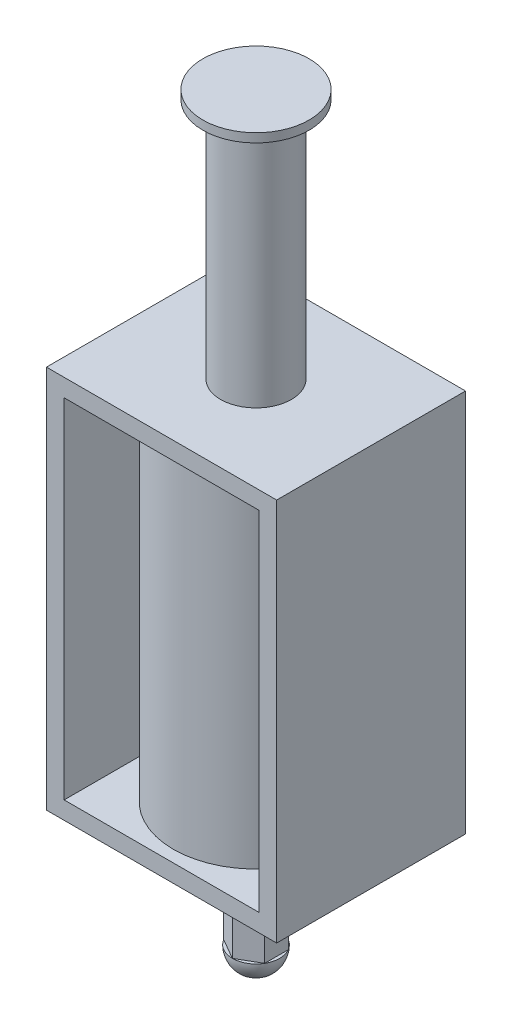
SolidWorks part; units mm, degrees
ref_plane "前视基准面" through (0, 0, 0) normal (0, 0, 1) x (1, 0, 0)
ref_plane "上视基准面" through (0, 0, 0) normal (0, 1, 0) x (1, 0, 0)
ref_plane "右视基准面" through (0, 0, 0) normal (1, 0, 0) x (0, 0, -1)
sketch "草图1" plane through (0, 0, 0) normal (0, 0, 1) x (1, 0, 0)
  line L1 (-19.5, 32.5) -> (19.5, 32.5)
  line L2 (-19.5, 32.5) -> (-19.5, -32.5)
  line L3 (-19.5, -32.5) -> (19.5, -32.5)
  line L4 (19.5, 32.5) -> (19.5, -32.5)
  line L5 (-19.5, 32.5) -> (19.5, -32.5) construction
  line L6 (-19.5, -32.5) -> (19.5, 32.5) construction
  point P0 (0, 0)
  dimension "D1" = 65
  dimension "D2" = 39
extrude "凸台-拉伸1" add sketch "草图1" along normal blind 32 contours L2 L1 L4 L3
sketch "草图2" plane through (0, 0, 32) normal (0, 0, 1) x (1, 0, 0)
  line L0 (19.5, 32.5) -> (19.5, -32.5) construction
  line L1 (-16.5, 29.5) -> (16.5, 29.5)
  line L2 (-16.5, 29.5) -> (-16.5, -29.5)
  line L3 (-16.5, -29.5) -> (16.5, -29.5)
  line L4 (16.5, 29.5) -> (16.5, -29.5)
  line L5 (-16.5, 29.5) -> (16.5, -29.5) construction
  line L6 (-16.5, -29.5) -> (16.5, 29.5) construction
  line L7 (-19.5, -32.5) -> (19.5, -32.5) construction
  point P0 (0, 0)
  dimension "D1" = 3
  dimension "D2" = 3
extrude "切除-拉伸1" cut sketch "草图2" against normal blind 32
sketch "草图3" plane through (0, 32.5, 0) normal (0, 1, 0) x (1, 0, 0)
  line L0 (-19.5, 0) -> (19.5, -32) construction
  line L2 (19.5, 0) -> (-19.5, -32) construction
  circle A1 centre (0, -16) radius 6
extrude "凸台-拉伸2" add sketch "草图3" along normal blind 41
sketch "草图4" plane through (0, 73.5, 0) normal (0, 1, 0) x (1, 0, 0)
  circle A0 centre (0, -16) radius 9
extrude "凸台-拉伸3" add sketch "草图4" along normal blind 1.5
sketch "草图5" plane through (0, 29.5, 0) normal (0, -1, 0) x (1, 0, 0)
  circle A0 centre (0, 16) radius 14
extrude "凸台-拉伸4" add sketch "草图5" along normal blind 59
sketch "草图6" plane through (0, -32.5, 0) normal (0, -1, 0) x (1, 0, 0)
  circle A0 centre (0, 16) radius 4
extrude "凸台-拉伸5" add sketch "草图6" along normal blind 18
sketch "草图7" plane through (0, -50.5, 0) normal (0, -1, 0) x (1, 0, 0)
  line L0 (0, 20) -> (3.4641, 18)
  line L1 (3.4641, 18) -> (3.4641, 14)
  line L2 (3.4641, 14) -> (0, 12)
  line L3 (0, 12) -> (-3.4641, 14)
  line L4 (-3.4641, 14) -> (-3.4641, 18)
  line L5 (-3.4641, 18) -> (0, 20)
  circle A0 centre (0, 16) radius 4 construction
  circle A1 centre (0, 16) radius 4 construction
  dimension "D5" = 4
  dimension "D1" = 120
  dimension "D2" = 120
  dimension "D3" = 120
  dimension "D4" = 120
extrude "切除-拉伸2" cut sketch "草图7" against normal blind 11 flip side to cut
ref_plane "基准面1" through (6.9282, 0, 12) normal (0.5, 0, 0.866) x (0.866, 0, -0.5)
sketch "草图9" plane through (6.9282, 0, 12) normal (0.5, 0, 0.866) x (0.866, 0, -0.5)
  line L0 (-6, -50.5) -> (-10, -50.5) construction
  line L1 (-8, -50.5) -> (-8, -54.5)
  line L2 (-4, -50.5) -> (-8, -50.5)
  arc A0 (-8, -54.5) -> (-4, -50.5) centre (-8, -50.5) ccw
revolve "旋转8" add sketch "草图9" angle 360 about L1
